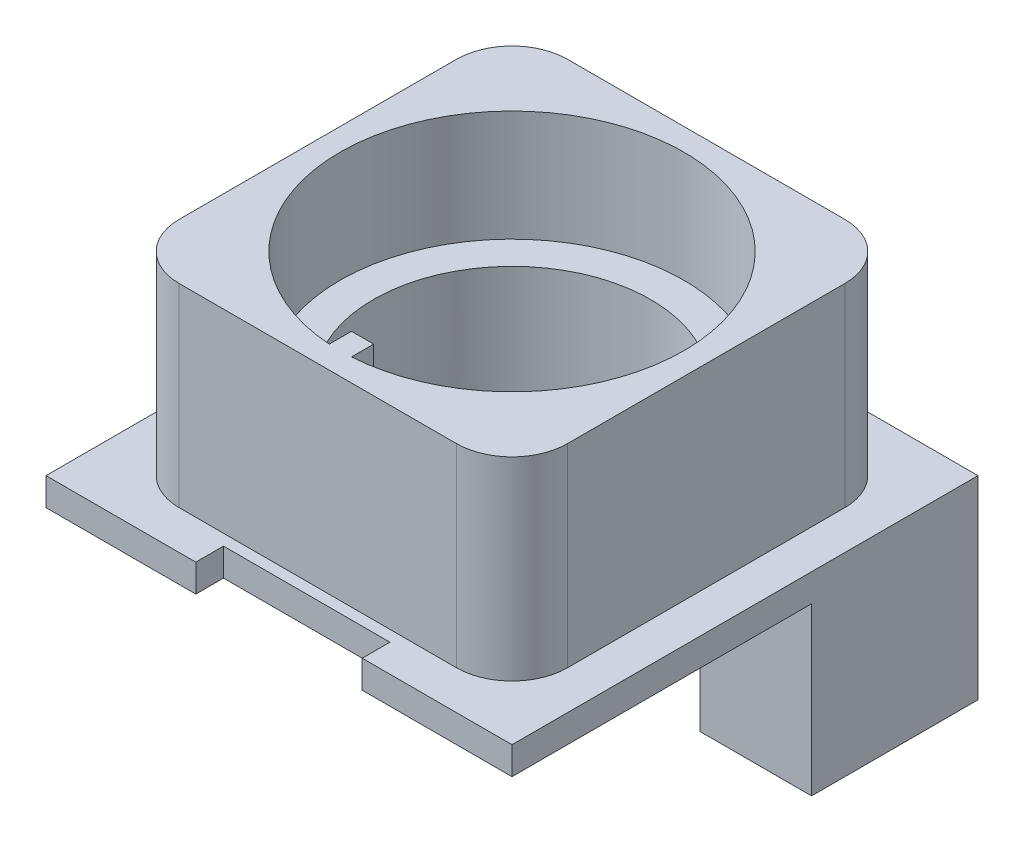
SolidWorks part; units mm, degrees
ref_plane "Front Plane" through (0, 0, 0) normal (0, 0, 1) x (1, 0, 0)
ref_plane "Top Plane" through (0, 0, 0) normal (0, 1, 0) x (1, 0, 0)
ref_plane "Right Plane" through (0, 0, 0) normal (1, 0, 0) x (0, 0, -1)
sketch "Sketch1" plane through (0, 0, 0) normal (0, 1, 0) x (1, 0, 0)
  line L1 (-8.4, -8.4) -> (8.4, -8.4)
  line L2 (-8.4, -8.4) -> (-8.4, 8.4)
  line L3 (-8.4, 8.4) -> (8.4, 8.4)
  line L4 (8.4, -8.4) -> (8.4, 8.4)
  line L5 (-8.4, -8.4) -> (8.4, 8.4) construction
  line L6 (-8.4, 8.4) -> (8.4, -8.4) construction
  point P0 (0, 0)
  dimension "D1" = 16.8
extrude "Boss-Extrude1" add sketch "Sketch1" along normal blind 1
sketch "Sketch2" plane through (0, 1, 0) normal (0, 1, 0) x (1, 0, 0)
  line L1 (-7, -7) -> (7, -7)
  line L2 (-7, -7) -> (-7, 7)
  line L3 (-7, 7) -> (7, 7)
  line L4 (7, -7) -> (7, 7)
  line L5 (-7, -7) -> (7, 7) construction
  line L6 (-7, 7) -> (7, -7) construction
  point P0 (0, 0)
  dimension "D1" = 14
extrude "Boss-Extrude2" add sketch "Sketch2" along normal blind 7
sketch "Sketch3" plane through (0, 8, 0) normal (0, 1, 0) x (1, 0, 0)
  circle A0 centre (0, 0) radius 6.2
  dimension "D1" = 12.4
extrude "Cut-Extrude1" cut sketch "Sketch3" against normal blind 4
sketch "Sketch4" plane through (0, 4, 0) normal (0, 1, 0) x (1, 0, 0)
  circle A0 centre (0, 0) radius 5
  dimension "D1" = 10
extrude "Cut-Extrude2" cut sketch "Sketch4" against normal through all
fillet "Fillet2" radius 2 4 edges at (-7, 4.5, 7) (-7, 4.5, -7) (7, 4.5, -7) (7, 4.5, 7)
sketch "Sketch6" plane through (0, 4, 0) normal (0, 1, 0) x (1, 0, 0)
  line L0 (0, -1000) -> (0, 49000) construction
  line L1 (-0.4, -6.1871) -> (-0.4, -5.3871)
  line L2 (-0.4, -5.3871) -> (0.4, -5.3871)
  line L3 (0.4, -5.3871) -> (0.4, -6.1871)
  circle A0 centre (0, 0) radius 6.2 construction
  arc A2 (-0.4, -6.1871) -> (0.4, -6.1871) centre (0, 0) ccw
  point P7 (0, -5.3871)
  dimension "D1" = 0.8
  dimension "D2" = 0.8
extrude "Boss-Extrude3" add sketch "Sketch6" along normal up to surface (4 mm away)
sketch "Sketch7" plane through (0, 1, 0) normal (0, 1, 0) x (1, 0, 0)
  line L0 (0, -1000) -> (0, 49000) construction
  line L1 (-3, 8.4) -> (-3, 7.4)
  line L2 (8.4, 8.4) -> (-8.4, 8.4) construction
  line L3 (-3, 7.4) -> (3, 7.4)
  line L4 (3, 7.4) -> (3, 8.4)
  line L5 (3, 8.4) -> (-3, 8.4)
  line L6 (-1000, 0) -> (49000, 0) construction
  line L7 (3, -7.4) -> (3, -8.4)
  line L8 (-3, -8.4) -> (-3, -7.4)
  line L9 (3, -8.4) -> (-3, -8.4)
  line L10 (-3, -7.4) -> (3, -7.4)
  point P8 (0, 7.4)
  dimension "D1" = 1
  dimension "D2" = 6
extrude "Cut-Extrude3" cut sketch "Sketch7" against normal through all
sketch "Sketch8" plane through (0, 1, 0) normal (0, 1, 0) x (1, 0, 0)
  line L0 (8.4, 8.4) -> (3, 8.4) construction
  line L1 (8.4, 8.4) -> (2.4, 8.4)
  line L2 (8.4, 8.4) -> (8.4, 2.4)
  line L3 (8.4, 2.4) -> (2.4, 2.4)
  line L4 (2.4, 8.4) -> (2.4, 2.4)
  line L5 (8.4, -8.4) -> (8.4, 8.4) construction
  line L6 (3, 8.4) -> (3, 7.4)
  line L7 (3, 7.4) -> (2.4, 7.4)
  circle A0 centre (0, 0) radius 5
  dimension "D3" = 10
  dimension "D1" = 6
  dimension "D2" = 6
extrude "Boss-Extrude4" add sketch "Sketch8" against normal blind 7 contours L4 L3 M5 M21 M22 M15 M14 M3 M4 | A0 L3 L4 M15 M22 M21
